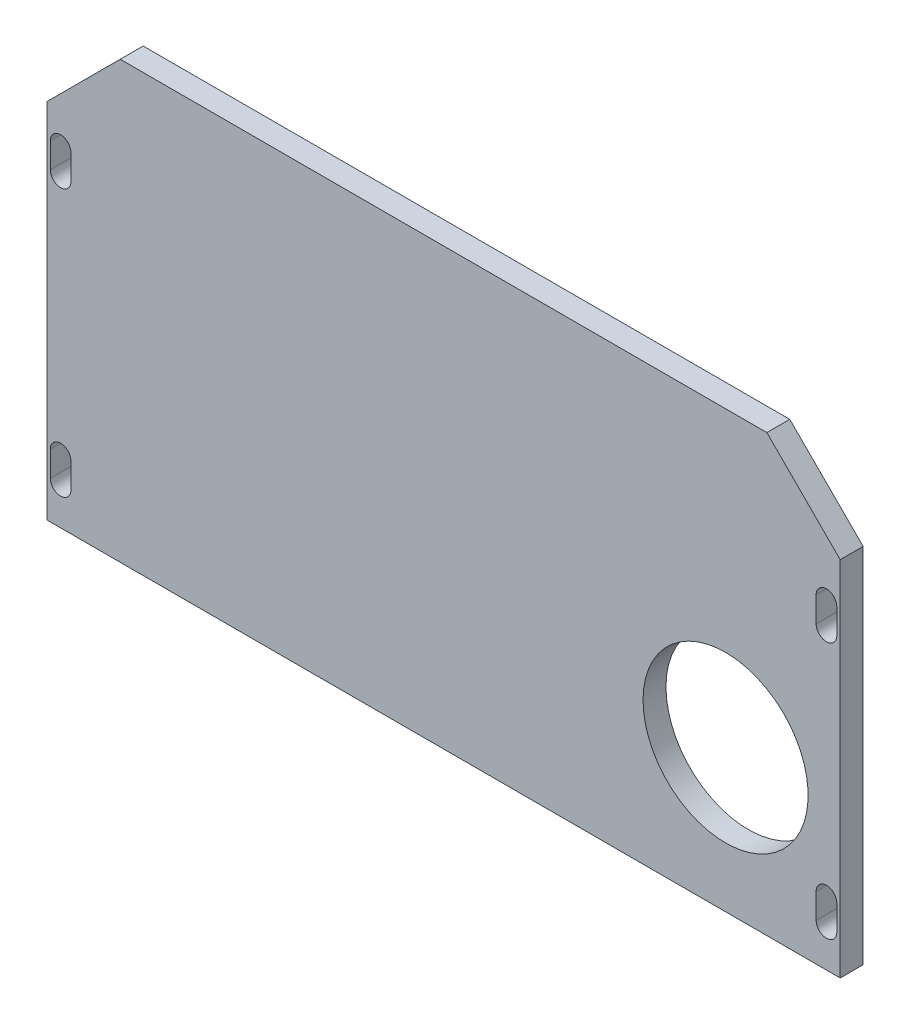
SolidWorks part; units mm, degrees
ref_plane "Спереди" through (0, 0, 0) normal (0, 0, 1) x (1, 0, 0)
ref_plane "Сверху" through (0, 0, 0) normal (0, 1, 0) x (1, 0, 0)
ref_plane "Справа" through (0, 0, 0) normal (1, 0, 0) x (0, 0, -1)
sketch "Эскиз1" plane through (0, 0, 0) normal (0, 0, 1) x (1, 0, 0)
  line L1 (0, 0) -> (173, 0)
  line L2 (0, 0) -> (0, 95)
  line L3 (0, 95) -> (173, 95)
  line L4 (173, 0) -> (173, 95)
  dimension "D1" = 95
  dimension "D2" = 173
extrude "Бобышка-Вытянуть1" add sketch "Эскиз1" along normal blind 5
sketch "Эскиз2" plane through (0, 0, 0) normal (0, 0, -1) x (-1, 0, 0)
  line L0 (-170, 69.75) -> (-170, 64.25) construction
  line L1 (-167.75, 69.75) -> (-167.75, 64.25)
  line L2 (-172.25, 69.75) -> (-172.25, 64.25)
  line L3 (-170, 13.75) -> (-170, 8.25) construction
  line L4 (-167.75, 13.75) -> (-167.75, 8.25)
  line L5 (-172.25, 13.75) -> (-172.25, 8.25)
  line L6 (-3, 72) -> (-3, 66.5) construction
  line L7 (-0.75, 72) -> (-0.75, 66.5)
  line L8 (-5.25, 72) -> (-5.25, 66.5)
  line L9 (-3, 13.75) -> (-3, 8.25) construction
  line L10 (-0.75, 13.75) -> (-0.75, 8.25)
  line L11 (-5.25, 13.75) -> (-5.25, 8.25)
  line L12 (-173, 0) -> (-173, 95) construction
  line L13 (0, 0) -> (-173, 0) construction
  line L14 (-86.5, 95) -> (-86.5, 0) construction
  line L15 (-173, 95) -> (0, 95) construction
  line L16 (-173, 47.5) -> (0, 47.5) construction
  line L17 (0, 95) -> (0, 0) construction
  circle A0 centre (-148, 31) radius 18
  arc A1 (-167.75, 69.75) -> (-172.25, 69.75) centre (-170, 69.75) ccw
  arc A2 (-172.25, 64.25) -> (-167.75, 64.25) centre (-170, 64.25) ccw
  arc A3 (-167.75, 13.75) -> (-172.25, 13.75) centre (-170, 13.75) ccw
  arc A4 (-172.25, 8.25) -> (-167.75, 8.25) centre (-170, 8.25) ccw
  arc A5 (-0.75, 72) -> (-5.25, 72) centre (-3, 72) ccw
  arc A6 (-5.25, 66.5) -> (-0.75, 66.5) centre (-3, 66.5) ccw
  arc A7 (-0.75, 13.75) -> (-5.25, 13.75) centre (-3, 13.75) ccw
  arc A8 (-5.25, 8.25) -> (-0.75, 8.25) centre (-3, 8.25) ccw
  point P4 (-170, 67)
  point P9 (-170, 11)
  point P16 (-3, 69.25)
  point P23 (-3, 11)
  point P34 (-170, 6)
  point P35 (-170, 16)
  point P39 (-3, 64.25)
  dimension "D1" = 36
  dimension "D4" = 10
  dimension "D5" = 2.25
  dimension "D6" = 6
  dimension "D7" = 2.25
  dimension "D8" = 10
  dimension "D9" = 3
  dimension "D11" = 56
  dimension "D12" = 2.25
  dimension "D13" = 10
  dimension "D14" = 2.25
  dimension "D15" = 10
  dimension "D17" = 6
  dimension "D2" = 25
  dimension "D3" = 31
  dimension "D10" = 3
  dimension "D16" = 167
  dimension "D18" = 56
extrude "Вырез-Вытянуть1" cut sketch "Эскиз2" against normal through all
chamfer "Фаска1" distance 16 angle 45 2 edges at (0, 95, 2.5) (173, 95, 2.5)
